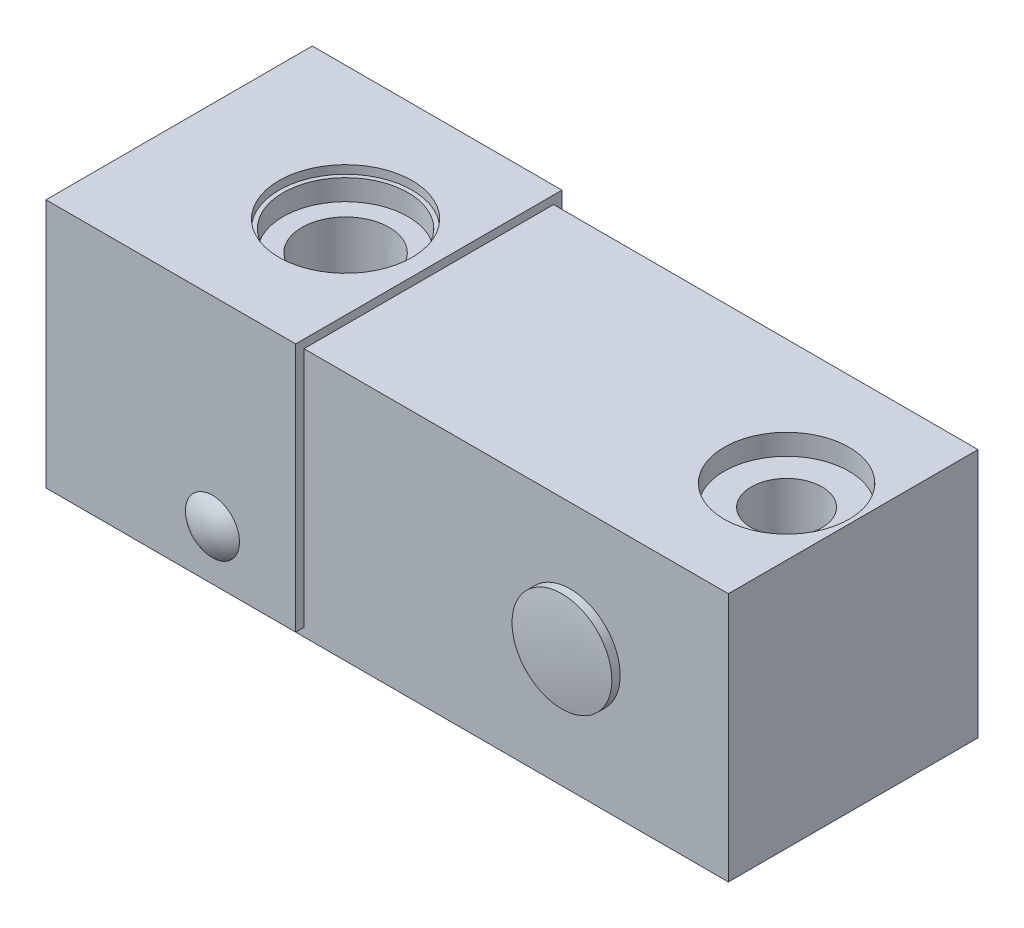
SolidWorks part; units mm, degrees
ref_plane "Front Plane" through (0, 0, 0) normal (0, 0, 1) x (1, 0, 0)
ref_plane "Top Plane" through (0, 0, 0) normal (0, 1, 0) x (1, 0, 0)
ref_plane "Right Plane" through (0, 0, 0) normal (1, 0, 0) x (0, 0, -1)
ref_plane "Plane1" through (0, 0, 0) normal (0, 1, 0) x (-1, 0, 0)
sketch "Sketch1" plane through (0, 0, 0) normal (0, 1, 0) x (-1, 0, 0)
  line L0 (30, 16) -> (0, 16)
  line L1 (0, 16) -> (0, 15)
  line L2 (0, 15) -> (-51, 15)
  line L3 (-51, 15) -> (-51, -15)
  line L4 (-51, -15) -> (0, -15)
  line L5 (0, -15) -> (0, -16)
  line L6 (0, -16) -> (30, -16)
  line L7 (30, -16) -> (30, 16)
extrude "Extrude1" add sketch "Sketch1" along normal blind 31
ref_plane "Plane2" through (0, 0, 0) normal (0, 0, 1) x (1, 0, 0)
sketch "Sketch2" plane through (0, 0, 0) normal (0, 0, 1) x (1, 0, 0)
  line L0 (0, 30) -> (51, 30)
  line L1 (51, 30) -> (51, 32)
  line L2 (51, 32) -> (0, 32)
  line L3 (0, 32) -> (0, 30)
extrude "Cut-Extrude1" cut sketch "Sketch2" against normal blind 15 and the other way blind 15
ref_plane "Plane3" through (0, 0, 0) normal (0, 0, 1) x (1, 0, 0)
sketch "Sketch3" plane through (0, 0, 0) normal (0, 0, 1) x (1, 0, 0)
  line L0 (-38, 30) -> (-38, 0)
  line L1 (-38, 0) -> (-23, 0)
  line L2 (-23, 0) -> (-23, 30)
  line L3 (-23, 30) -> (-38, 30)
extrude "Cut-Extrude2" cut sketch "Sketch3" against normal blind 15 and the other way blind 15
ref_plane "Plane4" through (0, 0, 0) normal (1, 0, 0) x (0, 0, -1)
sketch "Sketch4" plane through (0, 0, 0) normal (1, 0, 0) x (0, 0, -1)
  line L0 (-17, 0) -> (-15, 0)
  line L1 (-15, 0) -> (-15, 1)
  line L2 (-15, 1) -> (-17, 1)
  line L3 (-17, 1) -> (-17, 0)
extrude "Cut-Extrude3" cut sketch "Sketch4" against normal blind 30
ref_plane "Plane5" through (0, 0, 0) normal (1, 0, 0) x (0, 0, -1)
sketch "Sketch5" plane through (0, 0, 0) normal (1, 0, 0) x (0, 0, -1)
  line L0 (15, 0) -> (17, 0)
  line L1 (17, 0) -> (17, 1)
  line L2 (17, 1) -> (15, 1)
  line L3 (15, 1) -> (15, 0)
extrude "Cut-Extrude4" cut sketch "Sketch5" against normal blind 30
ref_plane "Plane6" through (0, 0, 0) normal (0, 0, 1) x (1, 0, 0)
sketch "Sketch6" plane through (0, 0, 0) normal (0, 0, 1) x (1, 0, 0)
  line L0 (-40.5, 12.5) -> (-40.5, 21.5)
  line L1 (-40.5, 21.5) -> (9.5, 21.5)
  line L2 (9.5, 21.5) -> (9.5, 18.5)
  line L3 (9.5, 18.5) -> (32.5, 18.5)
  line L4 (32.5, 18.5) -> (35.2978, 12.5)
  line L5 (35.2978, 12.5) -> (-40.5, 12.5)
  line L6 (35.2978, 12.5) -> (-40.5, 12.5) construction
revolve "Cut-Revolve1" cut sketch "Sketch6" angle 360 about L6
ref_plane "Plane7" through (0, 0, 0) normal (0, 0, 1) x (1, 0, 0)
sketch "Sketch7" plane through (0, 0, 0) normal (0, 0, 1) x (1, 0, 0)
  line L0 (43, 30) -> (47.25, 30)
  line L1 (47.25, 30) -> (47.25, 0)
  line L2 (47.25, 0) -> (43, 0)
  line L3 (43, 0) -> (43, 30)
  line L4 (43, 0) -> (43, 30) construction
revolve "Cut-Revolve2" cut sketch "Sketch7" angle 360 about L4
ref_plane "Plane8" through (0, 0, 0) normal (0, 0, 1) x (1, 0, 0)
sketch "Sketch8" plane through (0, 0, 0) normal (0, 0, 1) x (1, 0, 0)
  line L0 (43, 30) -> (50.5, 30)
  line L1 (50.5, 30) -> (50.5, 27.5)
  line L2 (50.5, 27.5) -> (43, 27.5)
  line L3 (43, 27.5) -> (43, 30)
  line L4 (43, 27.5) -> (43, 30) construction
revolve "Cut-Revolve3" cut sketch "Sketch8" angle 360 about L4
ref_plane "Plane9" through (0, 0, 11) normal (0, 0, 1) x (1, 0, 0)
sketch "Sketch9" plane through (0, 0, 11) normal (0, 0, 1) x (1, 0, 0)
  line L0 (43, 10.1934) -> (45.067, 9)
  line L1 (45.067, 9) -> (45.067, 0.433)
  line L2 (45.067, 0.433) -> (45.5, 0)
  line L3 (45.5, 0) -> (43, 0)
  line L4 (43, 0) -> (43, 10.1934)
  line L5 (43, 0) -> (43, 10.1934) construction
revolve "Cut-Revolve4" cut sketch "Sketch9" angle 360 about L5
ref_plane "Plane10" through (0, 0, 11) normal (0, 0, 1) x (1, 0, 0)
sketch "Sketch10" plane through (0, 0, 11) normal (0, 0, 1) x (1, 0, 0)
  line L0 (-16, 10.1934) -> (-13.933, 9)
  line L1 (-13.933, 9) -> (-13.933, 0.433)
  line L2 (-13.933, 0.433) -> (-13.5, 0)
  line L3 (-13.5, 0) -> (-16, 0)
  line L4 (-16, 0) -> (-16, 10.1934)
  line L5 (-16, 0) -> (-16, 10.1934) construction
revolve "Cut-Revolve5" cut sketch "Sketch10" angle 360 about L5
ref_plane "Plane11" through (0, 0, -11) normal (0, 0, 1) x (1, 0, 0)
sketch "Sketch11" plane through (0, 0, -11) normal (0, 0, 1) x (1, 0, 0)
  line L0 (43, 10.1934) -> (45.067, 9)
  line L1 (45.067, 9) -> (45.067, 0.433)
  line L2 (45.067, 0.433) -> (45.5, 0)
  line L3 (45.5, 0) -> (43, 0)
  line L4 (43, 0) -> (43, 10.1934)
  line L5 (43, 0) -> (43, 10.1934) construction
revolve "Cut-Revolve6" cut sketch "Sketch11" angle 360 about L5
ref_plane "Plane12" through (0, 0, -11) normal (0, 0, 1) x (1, 0, 0)
sketch "Sketch12" plane through (0, 0, -11) normal (0, 0, 1) x (1, 0, 0)
  line L0 (-16, 10.1934) -> (-13.933, 9)
  line L1 (-13.933, 9) -> (-13.933, 0.433)
  line L2 (-13.933, 0.433) -> (-13.5, 0)
  line L3 (-13.5, 0) -> (-16, 0)
  line L4 (-16, 0) -> (-16, 10.1934)
  line L5 (-16, 0) -> (-16, 10.1934) construction
revolve "Cut-Revolve7" cut sketch "Sketch12" angle 360 about L5
ref_plane "Plane13" through (0, 0, 0) normal (0, 0, 1) x (1, 0, 0)
sketch "Sketch13" plane through (0, 0, 0) normal (0, 0, 1) x (1, 0, 0)
  line L0 (-10, 31) -> (-2, 31)
  line L1 (-2, 31) -> (-2, 30)
  line L2 (-2, 30) -> (-4.75, 30)
  line L3 (-4.75, 30) -> (-4.75, 0)
  line L4 (-4.75, 0) -> (-10, 0)
  line L5 (-10, 0) -> (-10, 31)
  line L6 (-10, 0) -> (-10, 31) construction
revolve "Cut-Revolve8" cut sketch "Sketch13" angle 360 about L6
ref_plane "Plane14" through (0, 0, 0) normal (0, 0, 1) x (1, 0, 0)
sketch "Sketch14" plane through (0, 0, 0) normal (0, 0, 1) x (1, 0, 0)
  line L0 (-10, 30) -> (-2.5, 30)
  line L1 (-2.5, 30) -> (-2.5, 27.5)
  line L2 (-2.5, 27.5) -> (-10, 27.5)
  line L3 (-10, 27.5) -> (-10, 30)
  line L4 (-10, 27.5) -> (-10, 30) construction
revolve "Cut-Revolve9" cut sketch "Sketch14" angle 360 about L4
ref_plane "Plane15" through (32, 0, 0) normal (1, 0, 0) x (0, 0, -1)
sketch "Sketch15" plane through (32, 0, 0) normal (1, 0, 0) x (0, 0, -1)
  line L0 (15, 15) -> (15, 10.136)
  line L1 (15, 10.136) -> (14.419, 10.717)
  line L2 (14.419, 10.717) -> (-14.419, 10.717)
  line L3 (-14.419, 10.717) -> (-15, 10.136)
  line L4 (-15, 10.136) -> (-15, 15)
  line L5 (-15, 15) -> (15, 15)
  line L6 (-15, 15) -> (15, 15) construction
revolve "Cut-Revolve10" cut sketch "Sketch15" angle 360 about L6
ref_plane "Plane16" through (32, 0, 0) normal (1, 0, 0) x (0, 0, -1)
sketch "Sketch16" plane through (32, 0, 0) normal (1, 0, 0) x (0, 0, -1)
  line L0 (-9, 15) -> (-9, 10.717)
  line L1 (-9, 10.717) -> (-15, 10.717)
  line L2 (-15, 10.717) -> (-15, 9)
  line L3 (-15, 9) -> (-16, 9)
  line L4 (-16.4526, 15) -> (-9, 15)
  line L5 (-16.4526, 15) -> (-9, 15) construction
  arc A0 (-16, 9) -> (-16.4526, 15) centre (23.5474, 15) cw
revolve "Revolve1" add sketch "Sketch16" angle 360 about L5
ref_plane "Plane17" through (32, 0, 0) normal (1, 0, 0) x (0, 0, -1)
sketch "Sketch17" plane through (32, 0, 0) normal (1, 0, 0) x (0, 0, -1)
  line L0 (17, 15) -> (17, 6)
  line L1 (17, 6) -> (15, 6)
  line L2 (15, 6) -> (15, 8.4215)
  line L3 (15, 8.4215) -> (5, 8.4215)
  line L4 (5, 8.4215) -> (5, 15)
  line L5 (5, 15) -> (17, 15)
  line L6 (5, 15) -> (17, 15) construction
revolve "Revolve2" add sketch "Sketch17" angle 360 about L6
ref_plane "Plane18" through (0, 0, -17) normal (0, 0, -1) x (-1, 0, 0)
sketch "Sketch18" plane through (0, 0, -17) normal (0, 0, -1) x (-1, 0, 0)
  line L0 (-29.9793, 18.5) -> (-34.0207, 18.5)
  line L1 (-34.0207, 18.5) -> (-36.0415, 15)
  line L2 (-36.0415, 15) -> (-34.0207, 11.5)
  line L3 (-34.0207, 11.5) -> (-29.9793, 11.5)
  line L4 (-29.9793, 11.5) -> (-27.9585, 15)
  line L5 (-27.9585, 15) -> (-29.9793, 18.5)
extrude "Cut-Extrude5" cut sketch "Sketch18" against normal blind 5
ref_plane "Plane19" through (-10, 0, 0) normal (1, 0, 0) x (0, 0, -1)
sketch "Sketch19" plane through (-10, 0, 0) normal (1, 0, 0) x (0, 0, -1)
  line L0 (-12.2, 12) -> (-12.2, 2)
  line L1 (-12.2, 12) -> (-12.2, 2) construction
  arc A0 (-12.2, 2) -> (-12.2, 12) centre (-12.2, 7) cw
revolve "Revolve3" add sketch "Sketch19" angle 90 about L1
ref_plane "Plane20" through (-10, 0, 0) normal (1, 0, 0) x (0, 0, -1)
sketch "Sketch20" plane through (-10, 0, 0) normal (1, 0, 0) x (0, 0, -1)
  line L0 (12.2, 2) -> (12.2, 12)
  line L1 (12.2, 2) -> (12.2, 12) construction
  arc A0 (12.2, 12) -> (12.2, 2) centre (12.2, 7) cw
revolve "Revolve4" add sketch "Sketch20" angle 90 about L1
ref_plane "Plane21" through (0, 0, 0) normal (0, 0, 1) x (1, 0, 0)
sketch "Sketch21" plane through (0, 0, 0) normal (0, 0, 1) x (1, 0, 0)
  line L0 (30, 15) -> (32, 15)
  line L1 (32, 15) -> (32, 1.6)
  line L2 (32, 1.6) -> (34.25, 1.6)
  line L3 (34.25, 1.6) -> (34.25, 0)
  line L4 (34.25, 0) -> (30, 0)
  line L5 (30, 0) -> (30, 15)
  line L6 (30, 0) -> (30, 15) construction
revolve "Cut-Revolve11" cut sketch "Sketch21" angle 360 about L6
